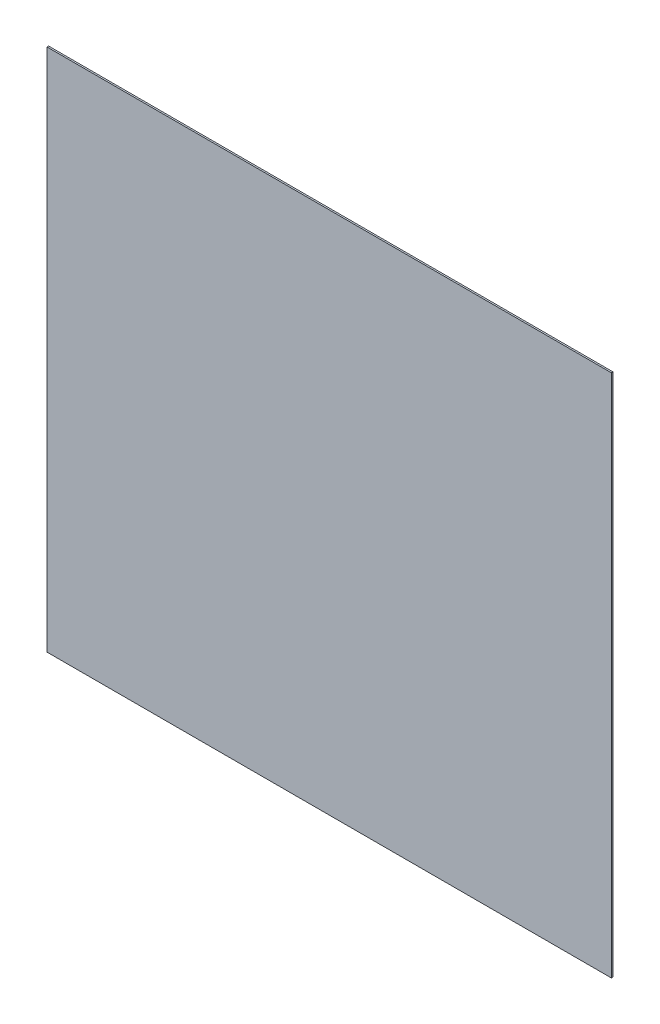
SolidWorks part; units mm, degrees
ref_plane "Front Plane" through (0, 0, 0) normal (0, 0, 1) x (1, 0, 0)
ref_plane "Top Plane" through (0, 0, 0) normal (0, 1, 0) x (1, 0, 0)
ref_plane "Right Plane" through (0, 0, 0) normal (1, 0, 0) x (0, 0, -1)
sketch "EW_SKETCH" plane through (0, 0, 0) normal (0, 0, 1) x (1, 0, 0)
  line L1 (0, 0) -> (700, 0)
  line L2 (0, 0) -> (0, 650)
  line L3 (0, 650) -> (700, 650)
  line L4 (700, 0) -> (700, 650)
  dimension "EW_HEIGHT" = 650
  dimension "EW_WIDTH" = 700
extrude "Extrude1" add sketch "EW_SKETCH" along normal blind 2
ref_plane "Plane1" through (350, 0, 0) normal (1, 0, 0) x (0, 0, -1)
